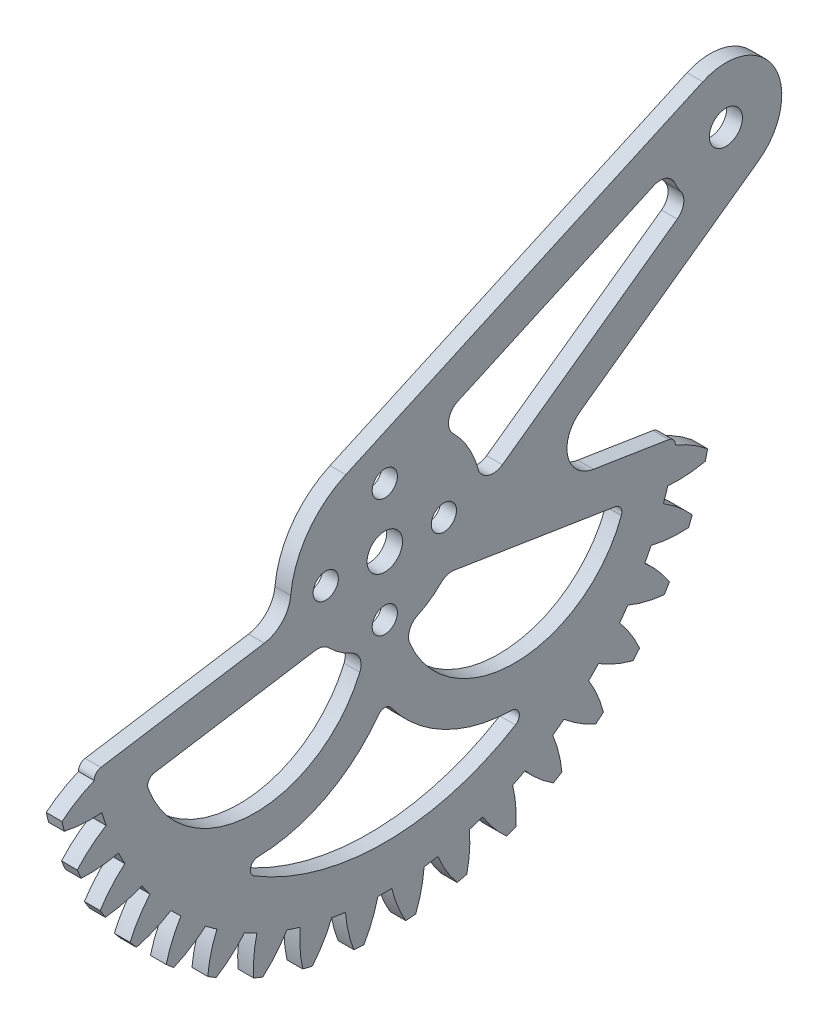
SolidWorks part; units mm, degrees
other "Bore"
ref_plane "Plan de face" through (0, 0, 0) normal (0, 0, 1) x (1, 0, 0)
ref_plane "Plan de dessus" through (0, 0, 0) normal (0, 1, 0) x (1, 0, 0)
ref_plane "Plan de droite" through (0, 0, 0) normal (1, 0, 0) x (0, 0, -1)
imported_body "Importée1"
sketch "Esquisse1" plane through (2, 0, 0) normal (1, 0, 0) x (0, 0, -1)
  line L0 (0, 0) -> (-3.9508, -0.6257) construction
  line L1 (0, 0) -> (0, -37.499) construction
  line L2 (-11.8523, -1.8772) -> (-37.0373, -5.8661)
  line L3 (-37.0373, -5.8661) -> (-41.8161, -3.9259)
  line L4 (37.0373, -5.8661) -> (41.8161, -3.9259)
  line L5 (11.8523, -1.8772) -> (37.0373, -5.8661)
  circle A0 centre (0, 0) radius 4 construction
  arc A2 (-37.1652, -4.9926) -> (-36.889, -6.7365) centre (0, 0) ccw construction
  arc A3 (-11.8523, -1.8772) -> (11.8523, -1.8772) centre (0, 0) cw
  arc A4 (36.889, -6.7365) -> (37.1652, -4.9926) centre (0, 0) ccw construction
  arc A5 (41.8161, -3.9259) -> (-41.8161, -3.9259) centre (0, 0) ccw
  arc A6 (-0.8828, -37.4886) -> (0.8828, -37.4886) centre (0, 0) ccw construction
  dimension "D1" = 12
extrude "Enlèv. mat.-Extru.1" cut sketch "Esquisse1" against normal through all
sketch "Esquisse2" plane through (2, 0, 0) normal (1, 0, 0) x (0, 0, -1)
  line L0 (0, 0) -> (10.3923, 6) construction
  line L1 (10.3923, 6) -> (43.3013, 25) construction
  line L2 (0, 0) -> (0, -37.499) construction
  line L3 (47.4368, 19.2287) -> (16.8727, -2.6724)
  line L4 (11.8523, -1.8772) -> (37.0373, -5.8661) construction
  line L5 (16.8727, -2.6724) -> (11.8523, -1.8772)
  line L6 (-4.9527, 10.9303) -> (40.3709, 31.4671)
  line L7 (26.8468, 15.5) -> (22.3441, 23.2989) construction
  line L8 (26.8468, 15.5) -> (31.3495, 7.7011) construction
  arc A0 (11.8523, -1.8772) -> (-11.8523, -1.8772) centre (0, 0) ccw construction
  circle A1 centre (43.3013, 25) radius 2.1
  arc A2 (-0.8828, -37.4886) -> (0.8828, -37.4886) centre (0, 0) ccw construction
  arc A3 (40.3709, 31.4671) -> (47.4368, 19.2287) centre (43.3013, 25) cw
  arc A4 (11.8523, -1.8772) -> (-4.9527, 10.9303) centre (0, 0) ccw
  dimension "D1" = 50
  dimension "D3" = 4.2
  dimension "D4" = 5
  dimension "D2" = 120
extrude "Boss.-Extru.1" add sketch "Esquisse2" against normal up to surface (2 mm away)
fillet "Congé1" radius 4 2 edges at (1, -2.6724, -16.8727) (1, -1.8772, 11.8523)
fillet "Congé4" radius 1 2 edges at (1, -5.8661, 37.0373) (1, -5.8661, -37.0373)
sketch "Esquisse3" plane through (2, 0, 0) normal (1, 0, 0) x (0, 0, -1)
  circle A0 centre (0, 0) radius 4
  circle A1 centre (0, 0) radius 2.25
  circle A2 centre (0, 0) radius 4 construction
  dimension "D1" = 4.5
extrude "Boss.-Extru.2" add sketch "Esquisse3" against normal up to surface (2 mm away)
sketch "Esquisse4" plane through (2, 0, 0) normal (1, 0, 0) x (0, 0, -1)
  circle A0 centre (0, 7.5) radius 1.6
  circle A1 centre (7.5, 0) radius 1.6
  circle A2 centre (0, -7.5) radius 1.6
  circle A3 centre (-7.5, 0) radius 1.6
  dimension "D1" = 3.2
extrude "Enlèv. mat.-Extru.2" cut sketch "Esquisse4" against normal through all
sketch "Esquisse5" plane through (2, 0, 0) normal (1, 0, 0) x (0, 0, -1)
  line L2 (-35.264, -10.6476) -> (-14.519, -7.3619)
  line L3 (-29.2572, -9.6962) -> (-8.8446, -6.4632)
  line L4 (0, 0) -> (0, -48.6512) construction
  line L5 (0, 0) -> (-2.5, -9.6825) construction
  line L6 (25.7177, -9.1356) -> (35.264, -10.6476)
  line L7 (8.8446, -6.4632) -> (29.2572, -9.6962)
  line L18 (42.4346, 26.9128) -> (-2.8891, 6.376)
  line L19 (34.1463, 23.1572) -> (9.2654, 11.8834)
  line L21 (21.8835, 7.0693) -> (44.5244, 23.293)
  line L22 (14.924, 2.0824) -> (37.1279, 17.9929)
  arc A0 (-7.1098, -7.0321) -> (-4.1807, -9.0842) centre (0, 0) ccw
  arc A1 (4.1807, -9.0842) -> (7.1098, -7.0321) centre (0, 0) ccw
  arc A2 (-3.1736, -11.6773) -> (-30.0259, -11.0655) centre (-16.479, -6.0731) cw
  arc A3 (-12.69, -29.3763) -> (-11.799, -29.7453) centre (0, 0) ccw
  arc A4 (-30.0395, -11.0285) -> (-30.0259, -11.0655) centre (0, 0) ccw
  arc A5 (-0.8063, -17.5701) -> (-16.0946, -25.5068) centre (-16.479, -6.0731) cw
  arc A6 (0.8063, -17.5701) -> (16.0946, -25.5068) centre (16.479, -6.0731) ccw
  arc A7 (3.1736, -11.6773) -> (30.0259, -11.0655) centre (16.479, -6.0731) ccw
  arc A8 (2.3412, -10.9325) -> (-34.7174, -12.7945) centre (-16.479, -6.0731) cw construction
  arc A9 (-16.5934, -27.3616) -> (16.5934, -27.3616) centre (0, 0) ccw
  arc A10 (30.0259, -11.0655) -> (30.0395, -11.0285) centre (0, 0) ccw
  arc A11 (0.8063, -17.5701) -> (-0.8063, -17.5701) centre (0, -18.1616) ccw
  arc A12 (-16.5934, -27.3616) -> (-16.0946, -25.5068) centre (-16.0749, -26.5066) cw
  arc A13 (16.5934, -27.3616) -> (16.0946, -25.5068) centre (16.0749, -26.5066) ccw
  arc A14 (30.0395, -11.0285) -> (29.2572, -9.6962) centre (29.1008, -10.6839) ccw
  arc A15 (-30.0395, -11.0285) -> (-29.2572, -9.6962) centre (-29.1008, -10.6839) cw
  arc A16 (8.8446, -6.4632) -> (7.1098, -7.0321) centre (8.5318, -8.4386) ccw
  arc A17 (3.1736, -11.6773) -> (4.1807, -9.0842) centre (5.0168, -10.901) cw
  arc A18 (-2.5, -9.6825) -> (-30.0259, -11.0655) centre (-16.479, -6.0731) cw construction
  circle A19 centre (43.3013, 25) radius 7.1
  arc A20 (36.8024, 22.1409) -> (37.5758, 20.8013) centre (43.3013, 25) ccw
  arc A21 (11.828, 3.1877) -> (8.6746, 8.6495) centre (0, 0) ccw
  circle A22 centre (0, 0) radius 2.25 construction
  arc A23 (-3.1736, -11.6773) -> (-4.1807, -9.0842) centre (-5.0168, -10.901) ccw
  arc A24 (36.8024, 22.1409) -> (34.1463, 23.1572) centre (34.9717, 21.3355) ccw
  arc A25 (37.5758, 20.8013) -> (37.1279, 17.9929) centre (35.963, 19.6186) cw
  arc A26 (11.828, 3.1877) -> (14.924, 2.0824) centre (13.7591, 3.7081) ccw
  arc A27 (8.6746, 8.6495) -> (9.2654, 11.8834) centre (10.0909, 10.0617) cw
  arc A28 (-8.8446, -6.4632) -> (-7.1098, -7.0321) centre (-8.5318, -8.4386) cw
  point P29 (0, -16.3812)
  point P42 (2.5, -9.6825)
  dimension "D4" = 10
  dimension "D7" = 5
  dimension "D12" = 2
  dimension "D11" = 10
  dimension "D5" = 5
  dimension "D3" = 20
  dimension "D6" = 2.5
  dimension "D13" = 1
  dimension "D14" = 2
  dimension "D2" = 5
  dimension "D8" = 5
  dimension "D9" = 5
  dimension "D10" = 5
extrude "Enlèv. mat.-Extru.3" cut sketch "Esquisse5" against normal through all
